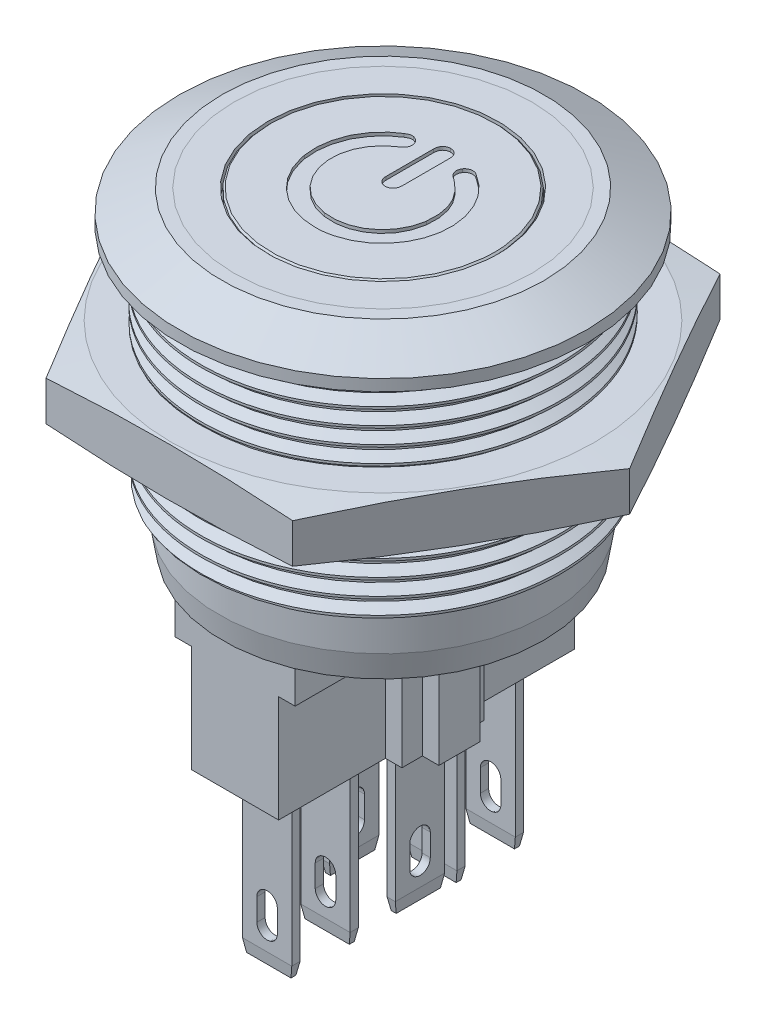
SolidWorks part; units mm, degrees
ref_plane "Front Plane" through (0, 0, 0) normal (0, 0, 1) x (1, 0, 0)
ref_plane "Top Plane" through (0, 0, 0) normal (0, 1, 0) x (1, 0, 0)
ref_plane "Right Plane" through (0, 0, 0) normal (1, 0, 0) x (0, 0, -1)
imported_body "Moai 130_Power Switch v3.step<1>"
sketch "Sketch4" plane through (0, 2, 0) normal (0, 1, 0) x (1, 0, 0)
sketch_block_instance "On-off-1"
sketch_block "On-off"
extrude "Cut-Extrude1" cut sketch "Sketch4" against normal blind 0.2
